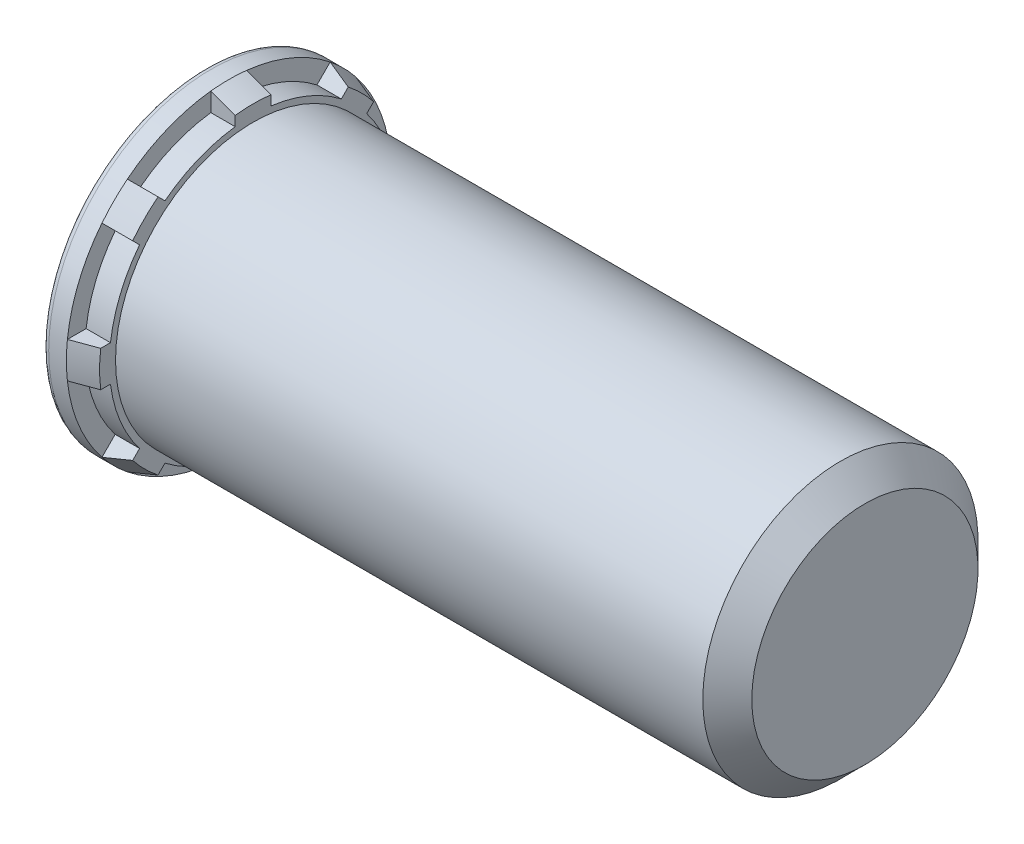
SolidWorks part; units mm, degrees
ref_plane "Plane1" through (0, 0, 0) normal (0, 0, 1) x (1, 0, 0)
ref_plane "Plane2" through (0, 0, 0) normal (0, 1, 0) x (1, 0, 0)
ref_plane "Plane3" through (0, 0, 0) normal (1, 0, 0) x (0, 0, -1)
sketch "BodySke" plane through (0, 0, 0) normal (0, 0, 1) x (1, 0, 0)
  line L0 (-0.4425, 2.8295) -> (-0.4425, 0)
  line L1 (0.4425, 2.7889) -> (0.4425, 2.5)
  line L2 (0, 2.95) -> (0.4425, 2.7889)
  line L3 (0.4425, 2.5) -> (11.1125, 2.5)
  line L4 (11.5575, 2.055) -> (11.5575, 0)
  line L5 (11.5575, 0) -> (-0.4425, 0)
  line L6 (0, 0) -> (50.554, 0) construction
  line L7 (-0.4425, 2.8295) -> (-0.44, 2.8295)
  line L8 (11.5575, 2.055) -> (11.1125, 2.5)
  line L9 (-0.322, 2.95) -> (0, 2.95)
  line L11 (0.8, 19.05) -> (0.8, -3.175) construction
  line L13 (-0.44, 2.8295) -> (-0.44, 2.832)
  arc A0 (-0.44, 2.832) -> (-0.322, 2.95) centre (-0.322, 2.832) cw
  dimension "D2" = 0.0025
  dimension "Fillet_rad" = 0.118
  dimension "D1" = 20
  dimension "Diameter" = 5
  dimension "D3" = 0.0025
  dimension "Head_ht" = 0.885
  dimension "Length" = 12
  dimension "Body_ch_ang" = 45
  dimension "Minor_dia" = 4.11
  dimension "Advance" = 0.8
  dimension "H_dia" = 5.9
  dimension "Clinch_ht" = 0.4425
revolve "BaseBody" add sketch "BodySke" angle 360 about L6
sketch "ThdSchSke" plane through (0, 0, 0) normal (0, 0, 1) x (1, 0, 0)
  line L0 (2.2575, -2.055) -> (1.9459, -2.5)
  line L1 (2.2575, -2.055) -> (2.5691, -2.5)
  line L2 (2.5691, -2.5) -> (2.5691, -3.125)
  line L3 (-3.175, 0) -> (5.1513, 0) construction
  line L5 (2.5691, -3.125) -> (1.9459, -3.125)
  line L6 (1.9459, -3.125) -> (1.9459, -2.5)
  line L7 (-0.4425, 2.8295) -> (-0.4425, -2.8295) construction
  dimension "Thread_minor" = 4.11
  dimension "Diameter" = 5
  dimension "Start" = 2.7
  dimension "SideAngle" = 55
  dimension "VeeAngle" = 70
  dimension "Overcut" = 6.25
revolve "ThreadSchematic" [suppressed] cut sketch "ThdSchSke" angle 360 about L3
pattern_linear "ThdSchPat" [suppressed]
sketch "RibCutSke" plane through (0.4425, 1.7944, -0.091) normal (1, 0, 0) x (0, 0, -1)
  line L0 (0.2354, 0.7976) -> (0.2354, 1.1375)
  line L1 (1.5112, 0.2692) -> (1.7515, 0.5095)
  line L2 (0.2354, 0.6842) -> (0.2354, 0.0891) construction
  line L3 (-0.091, -1.7944) -> (-0.091, 5.0239) construction
  line L4 (-0.091, -1.7944) -> (0.2354, 0.6842) construction
  line L5 (-0.091, -1.7944) -> (1.431, 0.189) construction
  line L6 (1.431, 0.189) -> (1.0152, -0.2268) construction
  arc A1 (1.5112, 0.2692) -> (0.2354, 0.7976) centre (-0.091, -1.7944) ccw
  arc A2 (1.7515, 0.5095) -> (0.2354, 1.1375) centre (-0.091, -1.7944) ccw
  circle A3 centre (-0.091, -1.7944) radius 2.7889 construction
  circle A4 centre (-0.091, -1.7944) radius 2.5 construction
  dimension "Inner_dia" = 5.225
  dimension "Outer_dia" = 5.9
  dimension "Rib_root_dia" = 5
  dimension "Rib_root_half_angle" = 7.5
  dimension "Rib_root_gap_angle" = 30
  dimension "Angle" = 45
extrude "RibCut" cut sketch "RibCutSke" against normal blind 0.4425
pattern_circular "RibCutsPat" count 8 every 45 about axis through (0, 0, 0) along (1, 0, 0) of "RibCut"
equation "' \"Length@BodySke\" = 12"
equation "' \"H_dia@BodySke\" = 5.9"
equation "' \"Start@ThdSchSke\" = 2.7"
equation "' \"Diameter@BodySke\" = 5"
equation "' \"Minor_dia@BodySke\" = 4.11"
equation "' \"Advance@BodySke\" = 0.8"
equation "\"Fillet_rad@BodySke\" =   \"H_dia@BodySke\" *0.02"
equation "\"Clinch_ht@BodySke\" = \"H_dia@BodySke\" * 0.075"
equation "\"Head_ht@BodySke\" =  \"H_dia@BodySke\" * 0.15"
equation "\"Num_ribs@RibCutsPat\" = 8"
equation "\"Angle@RibCutSke\" =\"Angle@RibCutsPat\""
equation "\"Rib_root_half_angle@RibCutSke\" = \"Angle@RibCutSke\" / 6"
equation "\"Rib_root_gap_angle@RibCutSke\" = \"Angle@RibCutSke\" - (2 * \"Rib_root_half_angle@RibCutSke\" )"
equation "\"Rib_root_dia@RibCutSke\" = \"Diameter@BodySke\""
equation "\"Inner_dia@RibCutSke\" = \"Diameter@BodySke\" + ( \"H_dia@BodySke\" - \"Diameter@BodySke\" ) / 4"
equation "\"Outer_dia@RibCutSke\" = \"H_dia@BodySke\""
equation "\"Depth@RibCut\" = \"Clinch_ht@BodySke\""
equation "\"Thread_length@ThreadCosmetic\" = \"Length@BodySke\" - \"Start@ThdSchSke\""
equation "\"Thread_minor@ThreadCosmetic\" = \"Minor_dia@BodySke\""
equation "\"Thread_minor@ThdSchSke\" = \"Minor_dia@BodySke\""
equation "\"Diameter@ThdSchSke\" = \"Diameter@BodySke\""
equation "\"Overcut@ThdSchSke\" = \"Diameter@BodySke\" * 1.25"
equation "\"Num_threads@ThdSchPat\" = int( \"Thread_length@ThreadCosmetic\" / \"Advance@BodySke\" + 0.999 )  + 1"
equation "\"Advance@ThdSchPat\" = \"Thread_length@ThreadCosmetic\" /  (\"Num_threads@ThdSchPat\" - 1) 'relax it"
equation "\"Num_threads@ThdSchPat\" = \"Num_threads@ThdSchPat\" - sgn( \"Num_threads@ThdSchPat\" - 1) '---chamfered tips only---"
